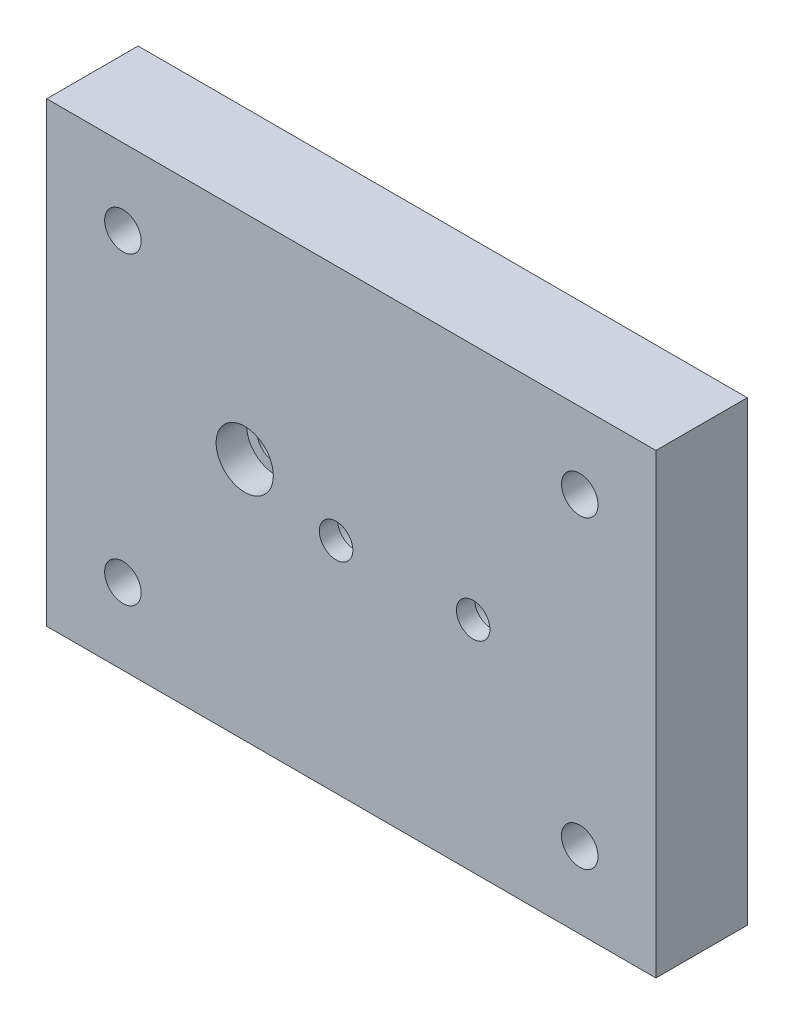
SolidWorks part; units mm, degrees
ref_plane "Plan1" through (0, 0, 0) normal (0, 0, 1) x (1, 0, 0)
ref_plane "Plan2" through (0, 0, 0) normal (0, 1, 0) x (1, 0, 0)
ref_plane "Plan3" through (0, 0, 0) normal (1, 0, 0) x (0, 0, -1)
sketch "Esquisse1" plane through (0, 0, 0) normal (0, 0, 1) x (1, 0, 0)
  line L1 (0, 0) -> (200, 0)
  line L2 (0, 0) -> (0, 150)
  line L3 (0, 150) -> (200, 150)
  line L4 (200, 0) -> (200, 150)
  dimension "D1" = 150
  dimension "D2" = 200
extrude "Base-Extrusion" add sketch "Esquisse1" along normal blind 30
sketch "Esquisse2" plane through (0, 0, 30) normal (0, 0, 1) x (1, 0, 0)
  line L0 (-10, 80) -> (90, 80) construction
  line L3 (200, 0) -> (200, 150) construction
  line L4 (200, 150) -> (0, 150) construction
  circle A5 centre (65, 80) radius 9.39
  dimension "D2" = 135
  dimension "D11" = 18.78
  dimension "D4" = 70
extrude "Enlèv. mat.-Extru.1" cut sketch "Esquisse2" against normal blind 10
sketch "Esquisse3" plane through (0, 0, 20) normal (0, 0, 1) x (1, 0, 0)
  circle A0 centre (65, 80) radius 6
  dimension "D1" = 12
extrude "Enlèv. mat.-Extru.2" cut sketch "Esquisse3" against normal blind 7
sketch "Esquisse10" plane through (0, 0, 13) normal (0, 0, 1) x (1, 0, 0)
  circle A0 centre (65, 80) radius 9
  dimension "D1" = 18
extrude "Enlèv. mat.-Extru.9" cut sketch "Esquisse10" against normal through all
sketch "Esquisse11" plane through (0, 0, 30) normal (0, 0, 1) x (1, 0, 0)
  line L0 (31.2407, 71.88) -> (187.6931, 71.88) construction
  line L1 (200, 0) -> (200, 150) construction
  circle A1 centre (95, 71.88) radius 5.5
  circle A2 centre (140, 71.88) radius 5.5
  circle A3 centre (65, 80) radius 6 construction
  dimension "D1" = 8.12
  dimension "D2" = 45
  dimension "D3" = 60
  dimension "D4" = 11
  dimension "D5" = 11
extrude "Enlèv. mat.-Extru.10" cut sketch "Esquisse11" against normal blind 6
sketch "Esquisse12" plane through (0, 0, 24) normal (0, 0, 1) x (1, 0, 0)
  circle A0 centre (140, 71.88) radius 10
  circle A1 centre (95, 71.88) radius 10
  dimension "D1" = 20
  dimension "D2" = 20
extrude "Enlèv. mat.-Extru.11" cut sketch "Esquisse12" against normal through all
sketch "Esquisse8" plane through (0, 0, 30) normal (0, 0, 1) x (1, 0, 0)
  line L1 (200, 0) -> (200, 150) construction
  line L2 (0, 0) -> (200, 0) construction
  circle A0 centre (25, 125) radius 6
  circle A1 centre (25, 25) radius 6
  circle A2 centre (175, 25) radius 6
  circle A3 centre (175, 125) radius 6
  dimension "D1" = 12
  dimension "D2" = 12
  dimension "D3" = 12
  dimension "D4" = 12
  dimension "D5" = 150
  dimension "D6" = 25
  dimension "D8" = 150
  dimension "D10" = 100
  dimension "D11" = 100
  dimension "D12" = 25
  dimension "D7" = 25
  dimension "D9" = 25
extrude "Enlèv. mat.-Extru.7" cut sketch "Esquisse8" against normal blind 18
sketch "Esquisse9" plane through (0, 0, 12) normal (0, 0, 1) x (1, 0, 0)
  circle A0 centre (25, 125) radius 9
  circle A1 centre (175, 125) radius 9
  circle A2 centre (175, 25) radius 9
  circle A3 centre (25, 25) radius 9
  dimension "D1" = 18
  dimension "D2" = 18
  dimension "D3" = 18
  dimension "D4" = 18
extrude "Enlèv. mat.-Extru.8" cut sketch "Esquisse9" against normal through all
